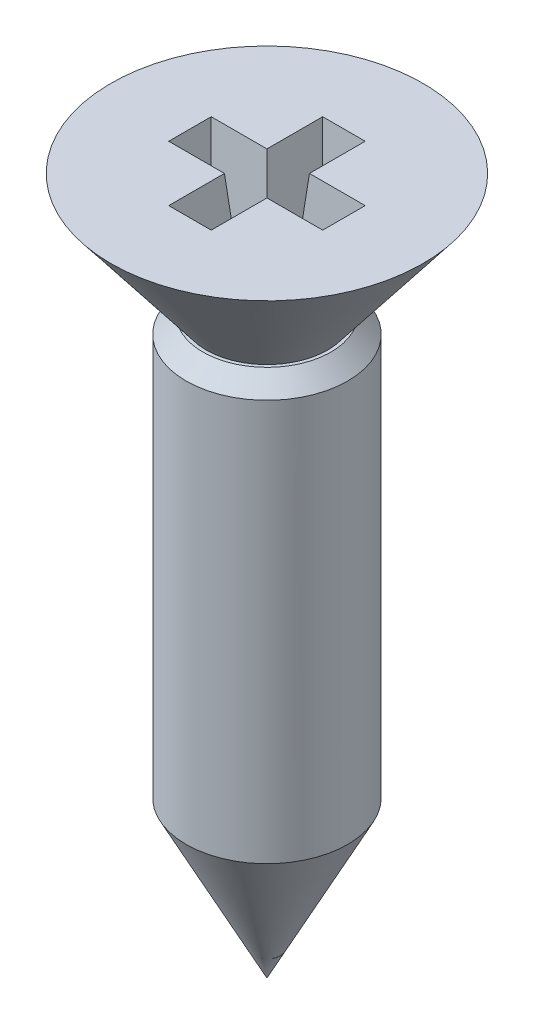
SolidWorks part; units mm, degrees
ref_plane "Face" through (0, 0, 0) normal (0, 0, 1) x (1, 0, 0)
ref_plane "Dessus" through (0, 0, 0) normal (0, 1, 0) x (1, 0, 0)
ref_plane "Droite" through (0, 0, 0) normal (1, 0, 0) x (0, 0, -1)
sketch "Esquisse1" plane through (0, 0, 0) normal (0, 0, 1) x (1, 0, 0)
  line L0 (0, 0) -> (0, -19.0471) construction
  line L1 (0, -3.4482) -> (2.8, -3.4482)
  line L2 (1.45, -5.6482) -> (1.45, -13.1482)
  line L3 (1.09, -5.6482) -> (2.8, -3.4482)
  line L5 (1.09, -5.6482) -> (1.45, -5.6482)
  line L7 (1.45, -13.1482) -> (0, -15.9482)
  line L8 (0, -3.4482) -> (0, -15.9482)
  dimension "D2" = 2.8
  dimension "D3" = 2.7864
  dimension "D4" = 0.36
  dimension "D5" = 3.1532
  dimension "D6" = 12.5
revolve "Révolution1" add sketch "Esquisse1" angle 360 about L0
chamfer "Chanfrein2" distance 0.3 angle 45 1 edges at (0, -5.6482, 1.45)
sketch "Esquisse2" plane through (0, -3.4482, 0) normal (0, 1, 0) x (-1, 0, 0)
  line L0 (0, 3.144) -> (0, -3.0562) construction
  line L1 (3.2044, 0) -> (-3.2702, 0) construction
  line L2 (0.25, -1.25) -> (-0.25, -1.25)
  line L3 (-0.25, -1.25) -> (-0.25, -0.25)
  line L4 (-1.25, -0.25) -> (-1.25, 0.25)
  line L5 (-1.25, 0.25) -> (-0.25, 0.25)
  line L6 (-0.25, 0.25) -> (-0.25, 1.25)
  line L7 (-0.25, 1.25) -> (0.25, 1.25)
  line L8 (0.25, 1.25) -> (0.25, 0.25)
  line L9 (0.25, 0.25) -> (1.25, 0.25)
  line L10 (1.25, 0.25) -> (1.25, -0.25)
  line L11 (1.25, -0.25) -> (0.25, -0.25)
  line L12 (0.25, -0.25) -> (0.25, -1.25)
  line L13 (-0.25, -0.25) -> (-1.25, -0.25)
  dimension "D1" = 0.5
  dimension "D2" = 0.5
  dimension "D3" = 0.5
  dimension "D4" = 1
  dimension "D5" = 1
extrude "Enlèv. mat.-Extru.1" cut sketch "Esquisse2" against normal blind 1.5
draft "Dépouille1" type of draft neutral plane draft angle 5 faces to draft 12 parameters "D1"=5
